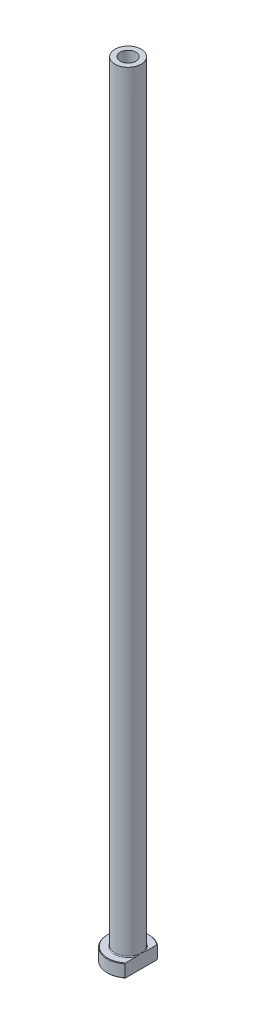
SolidWorks part; units mm, degrees
ref_plane "Front Plane" through (0, 0, 0) normal (0, 0, 1) x (1, 0, 0)
ref_plane "Top Plane" through (0, 0, 0) normal (0, 1, 0) x (1, 0, 0)
ref_plane "Right Plane" through (0, 0, 0) normal (1, 0, 0) x (0, 0, -1)
sketch "Sketch1" plane through (0, 0, 0) normal (0, 0, 1) x (1, 0, 0)
  line L0 (-3, 300) -> (-5, 300)
  line L1 (-5, 300) -> (-5, 5)
  line L2 (-5, 5) -> (-8, 5)
  line L3 (-8, 5) -> (-8, 0)
  line L4 (7.15, 0) -> (-7.15, 0) construction
  line L5 (-8, 0) -> (-3.25, 0)
  line L6 (-3, 255) -> (-3, 300)
  line L7 (0, 92.1877) -> (0, -15.5353) construction
  line L8 (0, -8.8) -> (0, 8.8) construction
  line L9 (-3, 255) -> (-3.25, 243)
  line L10 (-3.25, 243) -> (-3.25, 0)
  dimension "D1" = 0.25
  dimension "ID" = 6
  dimension "OD" = 10
  dimension "L" = 300
  dimension "H" = 16
  dimension "T" = 5
  dimension "N" = 45
  dimension "D2" = 12
  dimension "L-N" = 255
revolve "Revolve1" add sketch "Sketch1" angle 360 about L7
fillet "Fillet1" radius 0.3 1 edges at (0, 5, 5)
chamfer "Chamfer1" distance 0.2 angle 45 2 edges at (0, 5, 8) (0, 0, 8)
sketch "Sketch2" plane through (0, 0, 0) normal (0, -1, 0) x (1, 0, 0)
  line L0 (5, 6.245) -> (5, -6.245)
  circle A0 centre (0, 0) radius 8 construction
  arc A1 (5, 6.245) -> (5, -6.245) centre (0, 0) cw
  circle A2 centre (0, 0) radius 5 construction
extrude "Cut-Extrude1" cut sketch "Sketch2" against normal through all
chamfer "Chamfer2" distance 0.5 angle 45 1 edges at (0, 0, 3.25)
